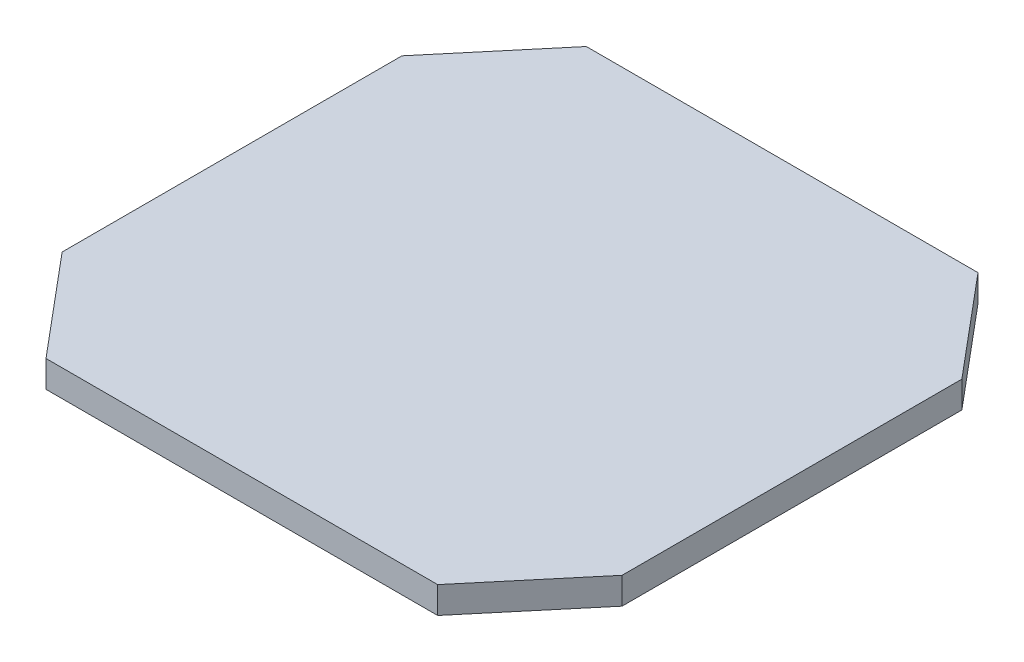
SolidWorks part; units mm, degrees
ref_plane "前视基准面" through (0, 0, 0) normal (0, 0, 1) x (1, 0, 0)
ref_plane "上视基准面" through (0, 0, 0) normal (0, 1, 0) x (1, 0, 0)
ref_plane "右视基准面" through (0, 0, 0) normal (1, 0, 0) x (0, 0, -1)
sketch "草图1" plane through (0, 0, 0) normal (0, 1, 0) x (1, 0, 0)
  line L0 (-11.2601, 20) -> (-11.9654, 16)
  line L1 (-11.2601, 20) -> (11.2601, 20)
  line L2 (-17, 10) -> (-17, -10)
  line L3 (-11.2601, -20) -> (11.2601, -20)
  line L4 (17, 10) -> (17, -10)
  line L5 (-12.7774, 15.0323) -> (12.7774, -15.0323) construction
  line L6 (-12.7774, -15.0323) -> (12.7774, 15.0323) construction
  line L7 (-11.9654, 16) -> (-17, 10)
  line L8 (11.2601, 20) -> (11.9654, 16)
  line L9 (11.9654, 16) -> (17, 10)
  line L10 (11.2601, -20) -> (11.9654, -16)
  line L11 (11.9654, -16) -> (17, -10)
  line L12 (-11.2601, -20) -> (-11.9654, -16)
  line L13 (-11.9654, -16) -> (-17, -10)
  point P0 (0, 0)
  dimension "D2" = 20
  dimension "D3" = 80
  dimension "D4" = 80
  dimension "D5" = 80
  dimension "D6" = 80
  dimension "D7" = 130
  dimension "D8" = 130
  dimension "D9" = 130
  dimension "D10" = 130
  dimension "D11" = 4
  dimension "D12" = 6
  dimension "D13" = 4
  dimension "D14" = 6
  dimension "D15" = 4
  dimension "D16" = 6
  dimension "D17" = 4
  dimension "D18" = 6
  dimension "D19" = 22.5202
extrude "凸台-拉伸1" add sketch "草图1" along normal blind 15
sketch "草图2" plane through (0, 15, 0) normal (0, 1, 0) x (1, 0, 0)
  line L1 (-14.5, 10.5) -> (14.5, 10.5)
  line L2 (-14.5, 10.5) -> (-14.5, -10.5)
  line L3 (-14.5, -10.5) -> (14.5, -10.5)
  line L4 (14.5, 10.5) -> (14.5, -10.5)
  line L7 (-14.5, 10.5) -> (14.5, -10.5) construction
  line L8 (-14.5, -10.5) -> (14.5, 10.5) construction
  point P0 (0, 0)
  dimension "D1" = 29
  dimension "D2" = 21
sketch "草图3" plane through (0, 15, 0) normal (0, 1, 0) x (1, 0, 0)
  line L0 (-11.2601, 20) -> (11.2601, 20)
  line L1 (11.2601, 20) -> (11.9654, 16)
  line L2 (11.9654, 16) -> (17, 10)
  line L3 (17, 10) -> (17, -10)
  line L4 (17, -10) -> (11.9654, -16)
  line L5 (11.9654, -16) -> (11.2601, -20)
  line L6 (11.2601, -20) -> (-11.2601, -20)
  line L7 (-11.2601, -20) -> (-11.9654, -16)
  line L8 (-11.9654, -16) -> (-17, -10)
  line L9 (-17, -10) -> (-17, 10)
  line L10 (-17, 10) -> (-11.9654, 16)
  line L11 (-11.9654, 16) -> (-11.2601, 20)
  line L12 (-14.5, 10.5) -> (14.5, 10.5) construction
  line L13 (14.5, 10.5) -> (14.5, -10.5) construction
  line L14 (14.5, -10.5) -> (-14.5, -10.5) construction
  line L15 (-14.5, -10.5) -> (-14.5, 10.5) construction
  line L16 (-14.8, 10.8) -> (14.8, 10.8)
  line L17 (14.8, 10.8) -> (14.8, -10.8)
  line L18 (14.8, -10.8) -> (-14.8, -10.8)
  line L19 (-14.8, -10.8) -> (-14.8, 10.8)
  dimension "D1" = 0.3
extrude "切除-拉伸3" cut sketch "草图3" against normal blind 1
sketch "草图5" plane through (0, 14, 0) normal (0, 1, 0) x (1, 0, 0)
  line L0 (-11.2601, 20) -> (11.2601, 20)
  line L1 (11.2601, 20) -> (11.9654, 16)
  line L2 (11.9654, 16) -> (17, 10)
  line L3 (17, 10) -> (17, -10)
  line L4 (17, -10) -> (11.9654, -16)
  line L5 (11.9654, -16) -> (11.2601, -20)
  line L6 (11.2601, -20) -> (-11.2601, -20)
  line L7 (-11.2601, -20) -> (-11.9654, -16)
  line L8 (-11.9654, -16) -> (-17, -10)
  line L9 (-17, -10) -> (-17, 10)
  line L10 (-17, 10) -> (-11.9654, 16)
  line L11 (-11.9654, 16) -> (-11.2601, 20)
  line L12 (11.2148, 15.65) -> (16.2, 9.7088) construction
  line L14 (13.7074, 12.6794) -> (16.2, 9.7088)
  line L15 (16.2, 9.7088) -> (16.2, -9.7088)
  line L16 (16.2, -9.7088) -> (13.7074, -12.6794)
  line L17 (16.2, -9.7088) -> (11.2148, -15.65) construction
  line L18 (11.2148, -15.65) -> (10.5888, -19.2) construction
  line L19 (-11.2148, 15.65) -> (-10.5888, 19.2) construction
  line L20 (-13.7074, -12.6794) -> (-16.2, -9.7088)
  line L21 (-16.2, -9.7088) -> (-16.2, 9.7088)
  line L22 (-16.2, 9.7088) -> (-13.7074, 12.6794)
  line L24 (-13.7074, -12.6794) -> (13.7074, -12.6794)
  line L25 (-13.7074, 12.6794) -> (13.7074, 12.6794)
  line L26 (-11.2148, -15.65) -> (-16.2, -9.7088) construction
  line L27 (-10.5888, -19.2) -> (-11.2148, -15.65) construction
  line L28 (10.5888, -19.2) -> (-10.5888, -19.2) construction
  line L29 (-16.2, 9.7088) -> (-11.2148, 15.65) construction
  line L30 (-10.5888, 19.2) -> (10.5888, 19.2) construction
  line L31 (10.5888, 19.2) -> (11.2148, 15.65) construction
  dimension "D1" = 0.8
extrude "切除-拉伸4" cut sketch "草图5" against normal blind 1
fillet "圆角5" radius 0.3 8 edges at (-14.9537, 14, 11.1941) (-16.2, 14, 0) (-14.9537, 14, -11.1941) (0, 14, -12.6794) (14.9537, 14, -11.1941) (16.2, 14, 0) (14.9537, 14, 11.1941) (0, 14, 12.6794)
fillet "圆角6" radius 0.2 8 edges at (-14.9537, 13, 11.1941) (-16.2, 13, 0) (-14.9537, 13, -11.1941) (0, 13, -12.6794) (14.9537, 13, -11.1941) (16.2, 13, 0) (14.9537, 13, 11.1941) (0, 13, 12.6794)
sketch "草图6" plane through (17, 0, 0) normal (1, 0, 0) x (0, 0, -1)
  line L0 (-15.5, 13) -> (-20, 10.4019)
  line L3 (15.5, 13) -> (20, 10.4019)
  line L6 (-16, 13) -> (-10, 13) construction
  line L7 (-20, 13) -> (-20, 0) construction
  line L8 (10, 13) -> (16, 13) construction
  line L9 (20, 13) -> (20, 0) construction
  line L10 (-15.5, 13) -> (-20, 13)
  line L11 (-20, 13) -> (-20, 10.4019)
  line L12 (20, 10.4019) -> (20, 13)
  line L13 (20, 13) -> (15.5, 13)
  point P13 (13, 13)
  point P14 (-13, 13)
  dimension "D1" = 2.5
  dimension "D2" = 60
  dimension "D3" = 60
  dimension "D4" = 2.5
extrude "切除-拉伸5" cut sketch "草图6" against normal up to next
sketch "草图7" plane through (0, 15, 0) normal (0, 1, 0) x (1, 0, 0)
  line L0 (-14.5, 10.5) -> (14.5, 10.5) construction
  line L1 (-14.5, 10.5) -> (-14.5, -10.5) construction
  line L2 (-14.5, -10.5) -> (14.5, -10.5) construction
  line L3 (14.5, 10.5) -> (14.5, -10.5) construction
  line L4 (-14.5, 10.5) -> (14.5, 10.5)
  line L5 (-14.5, 10.5) -> (-14.5, -10.5)
  line L6 (-14.5, -10.5) -> (14.5, -10.5)
  line L7 (14.5, 10.5) -> (14.5, -10.5)
extrude "切除-拉伸6" cut sketch "草图7" against normal up to next
sketch "草图8" plane through (0, 0, 0) normal (0, -1, 0) x (1, 0, 0)
  line L78 (10.9524, -17.138) -> (-10.9524, -17.138)
  line L79 (10.9691, 17.0434) -> (-10.9691, 17.0434)
  line L90 (10.5888, -19.2) -> (11.2148, -15.65)
  line L91 (11.2148, -15.65) -> (16.2, -9.7088)
  line L92 (16.2, -9.7088) -> (16.2, 9.7088)
  line L93 (16.2, 9.7088) -> (11.2148, 15.65)
  line L94 (11.2148, 15.65) -> (10.5888, 19.2)
  line L95 (10.5888, 19.2) -> (-10.5888, 19.2)
  line L96 (-10.5888, 19.2) -> (-11.2148, 15.65)
  line L97 (-11.2148, 15.65) -> (-16.2, 9.7088)
  line L98 (-16.2, 9.7088) -> (-16.2, -9.7088)
  line L99 (-16.2, -9.7088) -> (-11.2148, -15.65)
  line L100 (-11.2148, -15.65) -> (-10.5888, -19.2)
  line L101 (-10.5888, -19.2) -> (10.5888, -19.2)
  line L102 (10.9524, -17.138) -> (11.2148, -15.65)
  line L103 (11.2148, -15.65) -> (16.2, -9.7088)
  line L104 (16.2, -9.7088) -> (16.2, 9.7088)
  line L105 (16.2, 9.7088) -> (11.2148, 15.65)
  line L106 (11.2148, 15.65) -> (10.9691, 17.0434)
  line L108 (-10.9691, 17.0434) -> (-11.2148, 15.65)
  line L109 (-11.2148, 15.65) -> (-16.2, 9.7088)
  line L110 (-16.2, 9.7088) -> (-16.2, -9.7088)
  line L111 (-16.2, -9.7088) -> (-11.2148, -15.65)
  line L112 (-11.2148, -15.65) -> (-10.9524, -17.138)
  dimension "D1" = 0.8
extrude "切除-拉伸7" cut sketch "草图8" against normal offset from surface (10.5 mm away) 2.5
sketch "草图9" plane through (0, 10.5, 0) normal (0, -1, 0) x (1, 0, 0)
  line L0 (-12.385, 15.5) -> (12.385, 15.5) construction
  line L1 (-11.2148, 15.65) -> (-16.2, 9.7088) construction
  line L2 (11.2148, 15.65) -> (16.2, 9.7088) construction
  line L3 (16.2, 9.7088) -> (16.2, -9.7088) construction
  line L4 (-12.385, -15.5) -> (12.385, -15.5) construction
  line L5 (16.2, -9.7088) -> (11.2148, -15.65) construction
  line L6 (-11.2148, -15.65) -> (-16.2, -9.7088) construction
  line L7 (-11.2412, 15.5) -> (11.2412, 15.5)
  line L8 (-11.2148, 15.65) -> (-16.2, 9.7088)
  line L9 (11.2148, 15.65) -> (16.2, 9.7088)
  line L10 (16.2, 9.7088) -> (16.2, -9.7088)
  line L11 (-11.2412, -15.5) -> (11.2412, -15.5)
  line L12 (16.2, -9.7088) -> (11.2148, -15.65)
  line L13 (-11.2148, -15.65) -> (-16.2, -9.7088)
  line L14 (-16.2, 9.7088) -> (-16.2, -9.7088)
  line L15 (11.2148, 15.65) -> (11.2412, 15.5)
  line L16 (11.2148, 15.65) -> (10.9691, 17.0434) construction
  line L17 (-11.2148, 15.65) -> (-11.2412, 15.5)
  line L18 (-11.2148, 15.65) -> (-10.9691, 17.0434) construction
  line L19 (11.2148, -15.65) -> (11.2412, -15.5)
  line L20 (11.2148, -15.65) -> (10.9524, -17.138) construction
  line L21 (-11.2148, -15.65) -> (-11.2412, -15.5)
  line L22 (-10.9524, -17.138) -> (-11.2148, -15.65) construction
extrude "切除-拉伸8" cut sketch "草图9" against normal offset from surface (1.5 mm away) 1
sketch "草图11" plane through (0, 12, 0) normal (0, -1, 0) x (1, 0, 0)
  line L0 (-13.7074, 12.6794) -> (13.7074, 12.6794) construction
  line L1 (13.7074, 12.6794) -> (16.2, 9.7088) construction
  line L2 (16.2, 9.7088) -> (16.2, -9.7088) construction
  line L3 (16.2, -9.7088) -> (13.7074, -12.6794) construction
  line L4 (13.7074, -12.6794) -> (-13.7074, -12.6794) construction
  line L5 (-13.7074, -12.6794) -> (-16.2, -9.7088) construction
  line L6 (-16.2, -9.7088) -> (-16.2, 9.7088) construction
  line L7 (-16.2, 9.7088) -> (-13.7074, 12.6794) construction
  line L8 (-13.7074, 12.6794) -> (13.7074, 12.6794) construction
  line L9 (13.7074, 12.6794) -> (16.2, 9.7088) construction
  line L10 (16.2, 9.7088) -> (16.2, -9.7088) construction
  line L11 (16.2, -9.7088) -> (13.7074, -12.6794) construction
  line L12 (13.7074, -12.6794) -> (-13.7074, -12.6794) construction
  line L13 (-13.7074, -12.6794) -> (-16.2, -9.7088) construction
  line L14 (-16.2, -9.7088) -> (-16.2, 9.7088) construction
  line L15 (-16.2, 9.7088) -> (-13.7074, 12.6794) construction
  line L16 (-13.381, 11.9794) -> (13.381, 11.9794)
  line L17 (13.381, 11.9794) -> (15.5, 9.454)
  line L18 (15.5, 9.454) -> (15.5, -9.454)
  line L19 (15.5, -9.454) -> (13.381, -11.9794)
  line L20 (13.381, -11.9794) -> (-13.381, -11.9794)
  line L21 (-13.381, -11.9794) -> (-15.5, -9.454)
  line L22 (-15.5, -9.454) -> (-15.5, 9.454)
  line L23 (-15.5, 9.454) -> (-13.381, 11.9794)
  dimension "D1" = 0.7
extrude "切除-拉伸9" cut sketch "草图11" against normal offset from surface (1.2 mm away) 0.8
sketch "草图12" plane through (0, 10.5, 0) normal (0, -1, 0) x (1, 0, 0)
  line L0 (-11.2148, -15.65) -> (-10.9524, -17.138)
  line L1 (11.2148, 15.65) -> (10.9691, 17.0434)
  line L2 (10.9691, 17.0434) -> (-10.9691, 17.0434)
  line L3 (-10.9691, 17.0434) -> (-11.2148, 15.65)
  line L4 (11.2148, 15.65) -> (-11.2148, 15.65)
  line L5 (-10.9524, -17.138) -> (10.9524, -17.138)
  line L6 (10.9524, -17.138) -> (11.2148, -15.65)
  line L7 (11.2148, -15.65) -> (-11.2148, -15.65)
extrude "凸台-拉伸2" add sketch "草图12" along normal up to surface (10.5 mm away)
sketch "草图13" plane through (0, 0, 0) normal (0, -1, 0) x (1, 0, 0)
  line L4 (-10.2447, 20) -> (10.2447, 20)
  line L5 (-10.2447, 20) -> (-10.8354, 16.65)
  line L6 (10.2447, 20) -> (10.8354, 16.65)
  line L8 (-10.8354, 16.65) -> (10.8354, 16.65)
extrude "切除-拉伸10" cut sketch "草图13" against normal blind 4
mirror "镜向1" about plane through (0, 0, 0) normal (0, 0, 1) of "切除-拉伸10"
sketch "草图15" plane through (0, 0, 0) normal (0, -1, 0) x (1, 0, 0)
  line L1 (-10.421, 19) -> (-11.2148, 15.65)
  line L2 (-10.421, 19) -> (10.421, 19)
  line L4 (-10.2447, 20) -> (-10.8354, 16.65) construction
  line L5 (-11.2148, 15.65) -> (11.2148, 15.65)
  line L6 (11.2148, 15.65) -> (10.421, 19)
  line L7 (10.8354, 16.65) -> (10.2447, 20) construction
extrude "切除-拉伸13" cut sketch "草图15" against normal up to vertex (9.3787 mm away)
mirror "镜向2" about plane through (0, 0, 0) normal (0, 0, 1) of "切除-拉伸13"
sketch "草图16" plane through (0, 10.5, 0) normal (0, -1, 0) x (1, 0, 0)
  line L0 (-11.2148, 15.65) -> (-11.2412, 15.5)
  line L1 (-11.2412, 15.5) -> (11.2412, 15.5)
  line L2 (11.2412, 15.5) -> (11.2148, 15.65)
  line L3 (11.2148, 15.65) -> (-11.2148, 15.65)
  line L4 (-11.2412, -15.5) -> (-11.2148, -15.65)
  line L5 (-11.2148, -15.65) -> (11.2148, -15.65)
  line L6 (11.2148, -15.65) -> (11.2412, -15.5)
  line L7 (11.2412, -15.5) -> (-11.2412, -15.5)
extrude "切除-拉伸14" cut sketch "草图16" against normal up to surface (1.5 mm away)
sketch "草图18" plane through (0, 15, 0) normal (0, 1, 0) x (1, 0, 0)
  line L0 (-14.8, 10.8) -> (14.8, 10.8)
  line L1 (14.8, 10.8) -> (14.8, -10.8)
  line L2 (14.8, -10.8) -> (-14.8, -10.8)
  line L3 (-14.8, -10.8) -> (-14.8, 10.8)
extrude "切除-拉伸15" cut sketch "草图18" against normal blind 0.5
sketch "草图19" plane through (0, 10.4019, 0) normal (0, -1, 0) x (1, 0, 0)
  line L0 (-9.421, 19) -> (-10.421, 19)
  line L1 (10.421, 19) -> (-10.421, 19) construction
  line L2 (-10.421, 19) -> (-11.2148, 15.65)
  line L3 (-11.2148, 15.65) -> (-9.421, 15.65)
  line L5 (-11.2148, 15.65) -> (11.2148, 15.65) construction
  line L6 (-9.421, 15.65) -> (-9.421, 19)
  line L7 (11.2148, 15.65) -> (10.421, 19)
  line L8 (10.421, 19) -> (9.421, 19)
  line L9 (9.421, 19) -> (9.421, 15.65)
  line L10 (9.421, 15.65) -> (11.2148, 15.65)
  dimension "D1" = 1
  dimension "D2" = 1
extrude "凸台-拉伸3" add sketch "草图19" along normal up to surface (10.4019 mm away)
mirror "镜向3" about plane through (0, 0, 0) normal (0, 0, 1) of "凸台-拉伸3"
sketch "草图20" plane through (-17, 0, 0) normal (-1, 0, 0) x (0, 0, 1)
  line L0 (-10, 13) -> (-10, 0) construction
  line L1 (-9, 9.5) -> (-2.5, 9.5)
  line L2 (-9, 9.5) -> (-9, 3)
  line L3 (-9, 3) -> (-2.5, 3)
  line L4 (-2.5, 9.5) -> (-2.5, 3)
  line L5 (-9, 9.5) -> (-2.5, 3) construction
  line L6 (-9, 3) -> (-2.5, 9.5) construction
  line L7 (2.5, 9.5) -> (9, 9.5)
  line L8 (2.5, 9.5) -> (2.5, 3)
  line L9 (2.5, 3) -> (9, 3)
  line L10 (9, 9.5) -> (9, 3)
  line L11 (2.5, 9.5) -> (9, 3) construction
  line L12 (2.5, 3) -> (9, 9.5) construction
  line L13 (10, 13) -> (10, 0) construction
  line L14 (-10, 0) -> (10, 0) construction
  point P0 (-5.75, 6.25)
  point P5 (5.75, 6.25)
  dimension "D1" = 6.5
  dimension "D2" = 6.5
  dimension "D3" = 6.5
  dimension "D4" = 6.5
  dimension "D5" = 1
  dimension "D6" = 1
  dimension "D7" = 3
  dimension "D8" = 3
extrude "切除-拉伸16" cut sketch "草图20" against normal up to next
sketch "草图21" plane through (17, 0, 0) normal (1, 0, 0) x (0, 0, -1)
  line L0 (-10, 0) -> (10, 0) construction
  line L1 (-4.4, 8.3) -> (4.4, 8.3)
  line L2 (-4.4, 8.3) -> (-4.4, 4.5)
  line L3 (-4.4, 4.5) -> (4.4, 4.5)
  line L4 (4.4, 8.3) -> (4.4, 4.5)
  line L5 (-4.4, 8.3) -> (4.4, 4.5) construction
  line L6 (-4.4, 4.5) -> (4.4, 8.3) construction
  point P0 (0, 6.4)
  dimension "D1" = 8.8
  dimension "D2" = 3.8
  dimension "D3" = 4.5
extrude "切除-拉伸17" cut sketch "草图21" against normal up to next
sketch "草图24" plane through (0, 0, -20) normal (0, 0, -1) x (-1, 0, 0)
  line L0 (0, 10.4019) -> (0, 4) construction
  line L1 (11.2601, 10.4019) -> (-11.2601, 10.4019) construction
  line L2 (-10.2447, 4) -> (10.2447, 4) construction
  circle A1 centre (-5, 7.25) radius 3.1
  circle A2 centre (5, 7.25) radius 3.1
  dimension "D1" = 6.2
  dimension "D2" = 5
  dimension "D4" = 6.2
  dimension "D3" = 5
extrude "凸台-拉伸4" add sketch "草图24" against normal blind 6
sketch "草图25" plane through (0, 0, -20) normal (0, 0, -1) x (-1, 0, 0)
  circle A0 centre (-5, 7.25) radius 3.1 construction
  circle A2 centre (5, 7.25) radius 3.1 construction
  circle A3 centre (-5, 7.25) radius 3.1 construction
  circle A5 centre (5, 7.25) radius 3.1 construction
  circle A6 centre (-5, 7.25) radius 2.55
  circle A8 centre (5, 7.25) radius 2.55
  dimension "D1" = 5.1
extrude "切除-拉伸18" cut sketch "草图25" against normal up to next
ref_plane "基准面1" through (-5.874, 0.2154, -16.1318) normal (0.3421, -0.0125, 0.9396) x (-0.0161, 0.9997, 0.0192)
sketch "草图26" plane through (-5.874, 0.2154, -16.1318) normal (0.3421, -0.0125, 0.9396) x (-0.0161, 0.9997, 0.0192)
  line L0 (12.0709, 11.6408) -> (0.0747, 11.9016) construction
  line L1 (0.0747, 11.9016) -> (-0.12, 5.1871) construction
  line L2 (11.8763, 4.9263) -> (-0.12, 5.1871) construction
  line L3 (11.8763, 4.9263) -> (12.0709, 11.6408) construction
  line L4 (12.0709, 11.6408) -> (0.0747, 11.9016) construction
  line L5 (0.0747, 11.9016) -> (-0.12, 5.1871) construction
  line L6 (11.8763, 4.9263) -> (-0.12, 5.1871) construction
  line L7 (11.8763, 4.9263) -> (12.0709, 11.6408) construction
  line L8 (11.9736, 8.2836) -> (-0.0226, 8.5444) construction
  line L9 (6.0728, 11.7712) -> (5.8782, 5.0567) construction
  circle A0 centre (5.9755, 8.414) radius 3
  point P8 (5.9755, 8.414)
  dimension "D1" = 6
ref_plane "基准面2" through (-4.6766, 0.1715, -12.8433) normal (0.3421, -0.0125, 0.9396) x (-0.0161, 0.9997, 0.0192)
sketch "草图27" plane through (-4.6766, 0.1715, -12.8433) normal (0.3421, -0.0125, 0.9396) x (-0.0161, 0.9997, 0.0192)
  circle A1 centre (5.9755, 8.414) radius 3.1
  dimension "D1" = 6.2
extrude "凸台-拉伸5" add sketch "草图27" against normal up to surface (4.7982 mm away)
sketch "草图29" plane through (-5.874, 0.2154, -16.1318) normal (0.3421, -0.0125, 0.9396) x (-0.0161, 0.9997, 0.0192)
  circle A0 centre (5.9755, 8.414) radius 3.1 construction
  circle A1 centre (5.9755, 8.414) radius 3.1 construction
sketch "草图30" plane through (-4.6766, 0.1715, -12.8433) normal (0.3421, -0.0125, 0.9396) x (-0.0161, 0.9997, 0.0192)
  circle A0 centre (5.9755, 8.414) radius 3.1 construction
  circle A1 centre (5.9755, 8.414) radius 3.1 construction
  circle A2 centre (5.9755, 8.414) radius 2.55
  dimension "D1" = 5.1
extrude "切除-拉伸19" cut sketch "草图30" against normal up to next
mirror "镜向4" about plane through (0, 0, 0) normal (1, 0, 0) of "切除-拉伸19"
ref_plane "基准面3" through (5.874, 0.2154, -16.1318) normal (0.3421, 0.0125, -0.9396) x (0.0161, 0.9997, 0.0192)
ref_plane "基准面4" through (4.6766, 0.1715, -12.8433) normal (0.3421, 0.0125, -0.9396) x (0.0161, 0.9997, 0.0192)
sketch "草图31" plane through (4.6766, 0.1715, -12.8433) normal (0.3421, 0.0125, -0.9396) x (0.0161, 0.9997, 0.0192)
  circle A0 centre (5.9755, 8.414) radius 2.55 construction
  circle A1 centre (5.9755, 8.414) radius 2.55
  circle A2 centre (5.9755, 8.414) radius 3.1
  dimension "D1" = 6.2
extrude "凸台-拉伸6" add sketch "草图31" along normal up to next
sketch "草图32" plane through (0, 0, 0) normal (0, -1, 0) x (1, 0, 0)
  line L0 (-16.2, 9.7088) -> (-11.2148, 15.65) construction
  line L1 (-16.2, -9.7088) -> (-16.2, 9.7088) construction
  line L2 (-11.2148, 15.65) -> (11.2148, 15.65) construction
  line L3 (16.2, 9.7088) -> (11.2148, 15.65) construction
  line L4 (16.2, 9.7088) -> (16.2, -9.7088) construction
  line L5 (11.2148, -15.65) -> (16.2, -9.7088) construction
  line L6 (11.2148, -15.65) -> (-11.2148, -15.65) construction
  line L7 (-16.2, -9.7088) -> (-11.2148, -15.65) construction
  line L8 (-16.2, 9.7088) -> (-11.2148, 15.65) construction
  line L9 (-16.2, -9.7088) -> (-16.2, 9.7088) construction
  line L10 (-11.2148, 15.65) -> (11.2148, 15.65) construction
  line L11 (16.2, 9.7088) -> (11.2148, 15.65) construction
  line L12 (16.2, 9.7088) -> (16.2, -9.7088) construction
  line L13 (11.2148, -15.65) -> (16.2, -9.7088) construction
  line L14 (11.2148, -15.65) -> (-11.2148, -15.65) construction
  line L15 (-16.2, -9.7088) -> (-11.2148, -15.65) construction
  line L16 (-10.9816, 15.15) -> (10.9816, 15.15)
  line L17 (15.7, 9.5268) -> (10.9816, 15.15)
  line L18 (15.7, 9.5268) -> (15.7, -9.5268)
  line L19 (10.9816, -15.15) -> (15.7, -9.5268)
  line L20 (10.9816, -15.15) -> (-10.9816, -15.15)
  line L21 (-15.7, -9.5268) -> (-10.9816, -15.15)
  line L22 (-15.7, -9.5268) -> (-15.7, 9.5268)
  line L23 (-15.7, 9.5268) -> (-10.9816, 15.15)
  dimension "D1" = 0.5
extrude "凸台-拉伸8" add sketch "草图32" along normal blind 1.5 separate body
sketch "草图33" plane through (0, 0, 0) normal (0, -1, 0) x (1, 0, 0)
  line L0 (-11.2601, 20) -> (-11.9654, 16)
  line L1 (-11.9654, 16) -> (-17, 10)
  line L2 (-17, 10) -> (-17, -10)
  line L3 (-17, -10) -> (-11.9654, -16)
  line L4 (-11.9654, -16) -> (-11.2601, -20)
  line L5 (-11.2601, -20) -> (11.2601, -20)
  line L6 (11.2601, -20) -> (11.9654, -16)
  line L7 (11.9654, -16) -> (17, -10)
  line L8 (17, -10) -> (17, 10)
  line L9 (17, 10) -> (11.9654, 16)
  line L10 (11.9654, 16) -> (11.2601, 20)
  line L11 (11.2601, 20) -> (-11.2601, 20)
extrude "切除-拉伸20" cut sketch "草图33" against normal up to next
